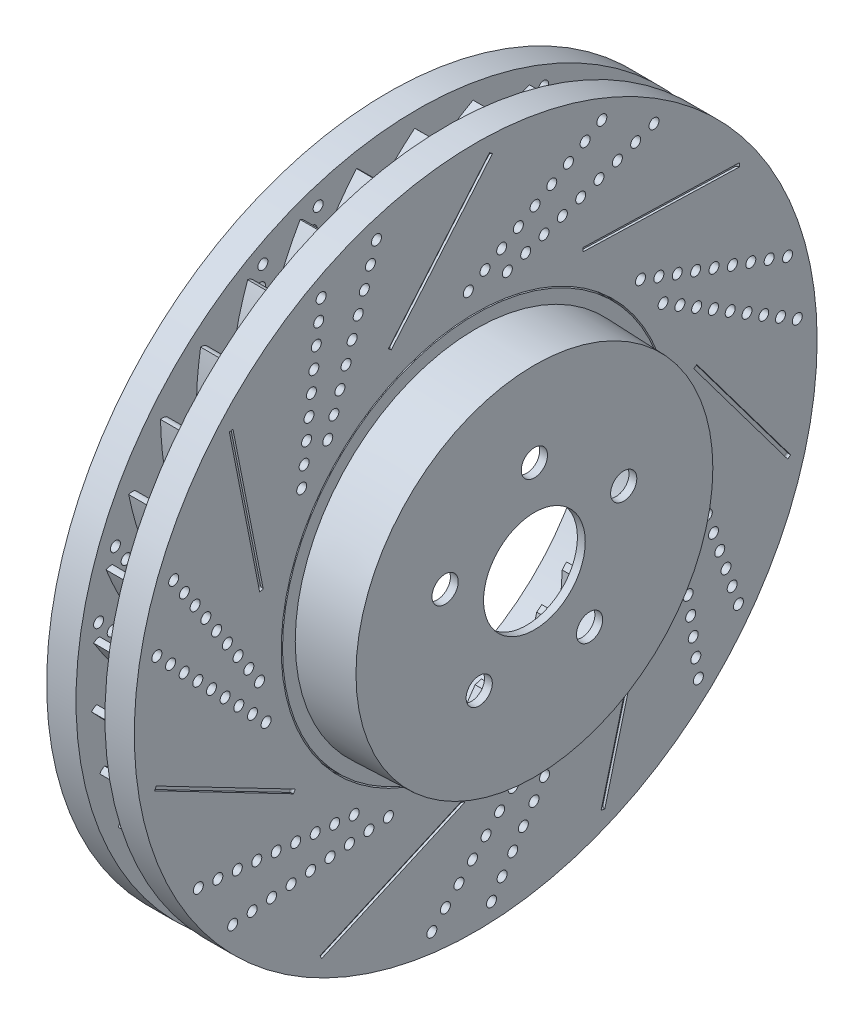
SolidWorks part; units mm, degrees
ref_plane "Front Plane" through (0, 0, 0) normal (0, 0, 1) x (1, 0, 0)
ref_plane "Top Plane" through (0, 0, 0) normal (0, 1, 0) x (1, 0, 0)
ref_plane "Right Plane" through (0, 0, 0) normal (1, 0, 0) x (0, 0, -1)
sketch "Sketch1" plane through (0, 0, 0) normal (1, 0, 0) x (0, 0, -1)
  circle A0 centre (0, 0) radius 87.27
  dimension "D1" = 174.54
extrude "Boss-Extrude1" add sketch "Sketch1" along normal blind 7.5
sketch "Sketch2" plane through (7.5, 0, 0) normal (1, 0, 0) x (0, 0, -1)
  circle A0 centre (0, 0) radius 49.72
  dimension "D1" = 99.44
extrude "Cut-Extrude1" cut sketch "Sketch2" against normal through all
sketch "Sketch3" plane through (7.5, 0, 0) normal (1, 0, 0) x (0, 0, -1)
  line L0 (0, -87.27) -> (0, 87.27) construction
  line L1 (-22.32, -50.7212) -> (-48.3823, -53.3272) construction
  line L2 (-31.0722, -45.884) -> (-58.4611, -43.348) construction
  line L3 (-48.3823, -53.3272) -> (-67.5581, -55.2445) construction
  line L4 (-58.4611, -43.348) -> (-76.684, -41.6607) construction
  circle A0 centre (0, 0) radius 55.415 construction
  circle A1 centre (0, 0) radius 87.27 construction
  circle A2 centre (-22.32, -50.7212) radius 1.28
  circle A3 centre (-31.0722, -45.884) radius 1.28
  circle A4 centre (-27.2952, -51.2187) radius 1.28
  circle A5 centre (-32.2704, -51.7161) radius 1.28
  circle A6 centre (-37.2456, -52.2136) radius 1.28
  circle A7 centre (-42.2208, -52.7111) radius 1.28
  circle A8 centre (-47.196, -53.2085) radius 1.28
  circle A9 centre (-52.1711, -53.706) radius 1.28
  circle A10 centre (-57.1463, -54.2035) radius 1.28
  circle A11 centre (-62.1215, -54.7009) radius 1.28
  circle A12 centre (-36.0509, -45.423) radius 1.28
  circle A13 centre (-41.0296, -44.962) radius 1.28
  circle A14 centre (-46.0083, -44.501) radius 1.28
  circle A15 centre (-50.987, -44.04) radius 1.28
  circle A16 centre (-55.9657, -43.5791) radius 1.28
  circle A17 centre (-60.9444, -43.1181) radius 1.28
  circle A18 centre (-65.9231, -42.6571) radius 1.28
  circle A19 centre (-70.9019, -42.1961) radius 1.28
  dimension "D1" = 110.83
  dimension "D2" = 2.56
  dimension "D3" = 10
  dimension "D4" = 22.32
  dimension "D5" = 84.29
  dimension "D6" = 95.29
  dimension "D7" = 9
  dimension "D8" = 9
extrude "Cut-Extrude2" cut sketch "Sketch3" against normal through all
pattern_circular "CirPattern1" count 7 over 360 about axis through (0, 0, 0) along (1, 0, 0) of "Cut-Extrude2"
sketch "Sketch5" plane through (7.5, 0, 0) normal (1, 0, 0) x (0, 0, -1)
  line L0 (0, 0) -> (0, -97.8104) construction
  line L1 (-3.2223, -56.4491) -> (-2.84, -57.3078)
  line L2 (-3.2223, -56.4491) -> (-39.7642, -72.7186)
  line L3 (-2.84, -57.3078) -> (-39.3818, -73.5773)
  line L4 (-39.7642, -72.7186) -> (-39.3818, -73.5773)
  dimension "D1" = 2.84
  dimension "D2" = 66
  dimension "D3" = 0.94
  dimension "D4" = 40
extrude "Cut-Extrude3" cut sketch "Sketch5" against normal blind 0.6
fillet "Fillet1" radius 0.6 2 edges at (6.9, -73.1479, 39.573) (6.9, -56.8785, 3.0312)
pattern_circular "CirPattern2" count 7 over 360 about axis through (0, 0, 0) along (1, 0, 0) of "Fillet1", "Cut-Extrude3"
ref_plane "Plane1" through (-3.7, 0, 0) normal (-1, 0, 0) x (0, 0, 1)
mirror "Mirror2" about plane through (-3.7, 0, 0) normal (-1, 0, 0)
sketch "Sketch8" plane through (0, 0, 0) normal (-1, 0, 0) x (0, 0, 1)
  line L0 (0, 0) -> (0, -49.72) construction
  line L1 (0, 0) -> (-188.7767, 0) construction
  circle A0 centre (0, 0) radius 49.72 construction
  arc A1 (-36.7738, 33.4629) -> (-37.8669, 32.2207) centre (0, 0) ccw
  arc A2 (-81.2799, 10.8679) -> (-82.5799, 11.8995) centre (-80.4495, 13.2494) cw
  arc A3 (-30.2078, 39.4914) -> (-31.5051, 38.4643) centre (0, 0) ccw
  arc A4 (-78.0331, 25.2064) -> (-79.1281, 26.4534) centre (-76.7909, 27.4013) cw
  arc A5 (-22.6709, 44.2505) -> (-24.1307, 43.4717) centre (0, 0) ccw
  arc A6 (-72.2783, 38.7346) -> (-73.133, 40.1572) centre (-70.6641, 40.6725) cw
  arc A7 (-14.4053, 47.5875) -> (-15.9808, 47.0818) centre (0, 0) ccw
  arc A8 (-64.2005, 51.018) -> (-64.7874, 52.5703) centre (-62.2662, 52.6364) cw
  arc A9 (-5.6767, 49.3949) -> (-7.3172, 49.1786) centre (0, 0) ccw
  arc A10 (-54.0591, 61.6615) -> (-54.3595, 63.2937) centre (-51.8669, 62.9086) cw
  arc A11 (3.2343, 49.6147) -> (1.5816, 49.6948) centre (0, 0) ccw
  arc A12 (-42.1803, 70.3232) -> (-42.1844, 71.9828) centre (-39.8006, 71.1588) cw
  arc A13 (12.0414, 48.2399) -> (10.4295, 48.6138) centre (0, 0) ccw
  arc A14 (-28.9457, 76.7247) -> (-28.6534, 78.3583) centre (-26.4551, 77.1219) cw
  arc A15 (20.4614, 45.3146) -> (18.9422, 45.9703) centre (0, 0) ccw
  arc A16 (-14.7808, 80.6601) -> (-14.2015, 82.2153) centre (-12.2593, 80.6063) cw
  arc A17 (28.2238, 40.9328) -> (26.8461, 41.8493) centre (0, 0) ccw
  arc A18 (-0.1409, 82.0031) -> (0.7068, 83.4298) centre (2.3305, 81.4999) cw
  arc A19 (35.0791, 35.2354) -> (33.8872, 36.3832) centre (0, 0) ccw
  arc A20 (14.5036, 80.7104) -> (15.5924, 81.9629) centre (16.8454, 79.7741) cw
  arc A21 (40.8069, 28.4056) -> (39.8391, 29.7477) centre (0, 0) ccw
  arc A22 (28.6819, 76.8237) -> (29.9769, 77.8616) centre (30.8189, 75.4842) cw
  arc A23 (45.2231, 20.6627) -> (44.5105, 22.1561) centre (0, 0) ccw
  arc A24 (41.9384, 70.4677) -> (43.3979, 71.2577) centre (43.8019, 68.7682) cw
  arc A25 (48.1858, 12.2558) -> (47.7513, 13.8524) centre (0, 0) ccw
  arc A26 (53.8469, 61.8469) -> (55.424, 62.3636) centre (55.377, 59.8419) cw
  arc A27 (49.5998, 3.4549) -> (49.4574, 5.1034) centre (0, 0) ccw
  arc A28 (64.0248, 51.2383) -> (65.6688, 51.4651) centre (65.1723, 48.9923) cw
  arc A29 (49.4196, -5.457) -> (49.5738, -3.8095) centre (0, 0) ccw
  arc A30 (72.1448, 38.9828) -> (73.8029, 38.9124) centre (72.8728, 36.568) cw
  arc A31 (47.651, -14.1935) -> (48.097, -12.6001) centre (0, 0) ccw
  arc A32 (77.9461, 25.4744) -> (79.5649, 25.109) centre (78.2312, 22.9684) cw
  arc A33 (44.3509, -22.4738) -> (45.0742, -20.9856) centre (0, 0) ccw
  arc A34 (81.2421, 11.1472) -> (82.7697, 10.4987) centre (81.0752, 8.6306) cw
  arc A35 (39.6253, -30.0318) -> (40.6027, -28.6967) centre (0, 0) ccw
  arc A36 (81.9269, -3.5383) -> (83.3141, -4.4492) centre (81.3133, -5.9846) cw
  arc A37 (33.6261, -36.6246) -> (34.8262, -35.4854) centre (0, 0) ccw
  arc A38 (79.9785, -18.1101) -> (81.1808, -19.254) centre (78.938, -20.4075) cw
  arc A39 (26.5462, -42.0402) -> (27.9304, -41.1336) centre (0, 0) ccw
  arc A40 (75.4595, -32.0997) -> (76.4383, -33.4399) centre (74.0255, -34.1745) cw
  arc A41 (18.613, -46.1046) -> (20.1368, -45.4597) centre (0, 0) ccw
  arc A42 (68.5152, -45.0577) -> (69.2389, -46.5511) centre (66.7338, -46.843) cw
  arc A43 (10.0816, -48.6872) -> (11.6961, -48.3247) centre (0, 0) ccw
  arc A44 (59.3688, -56.5675) -> (59.8142, -58.1661) centre (57.2972, -58.006) cw
  arc A45 (1.2261, -49.7049) -> (2.8794, -49.6366) centre (0, 0) ccw
  arc A46 (48.3142, -66.2591) -> (48.467, -67.9116) centre (46.019, -67.3047) cw
  arc A47 (-7.6687, -49.125) -> (-6.0298, -49.353) centre (0, 0) ccw
  arc A48 (35.7068, -73.8211) -> (35.562, -75.4744) centre (33.2618, -74.4401) cw
  arc A49 (-16.3171, -46.9663) -> (-14.7452, -47.4832) centre (0, 0) ccw
  arc A50 (21.9517, -79.0105) -> (21.5141, -80.6113) centre (19.4355, -79.1829) cw
  arc A51 (-24.441, -43.298) -> (-22.9867, -44.0873) centre (0, 0) ccw
  arc A52 (7.491, -81.6604) -> (6.7746, -83.1573) centre (4.9845, -81.3807) cw
  arc A53 (-31.7794, -38.2381) -> (-30.4894, -39.2743) centre (0, 0) ccw
  arc A54 (-7.2104, -81.6856) -> (-8.1825, -83.0306) centre (-9.6267, -80.9629) cw
  arc A55 (-38.0963, -31.9491) -> (-37.0121, -33.1991) centre (0, 0) ccw
  arc A56 (-21.68, -79.0854) -> (-22.8767, -80.2352) centre (-23.9285, -77.9429) cw
  arc A57 (-43.1889, -24.6333) -> (-42.3453, -26.0568) centre (0, 0) ccw
  arc A58 (-35.4529, -73.9434) -> (-36.8357, -74.861) centre (-37.4612, -72.4177) cw
  arc A59 (-46.8932, -16.5258) -> (-46.3174, -18.077) centre (0, 0) ccw
  arc A60 (-48.0862, -66.4247) -> (-49.6106, -67.0807) centre (-49.7899, -64.565) cw
  arc A61 (-49.0904, -7.8871) -> (-48.8008, -9.5162) centre (0, 0) ccw
  arc A62 (-59.1741, -56.7711) -> (-60.7911, -57.1444) centre (-60.5183, -54.6371) cw
  arc A63 (-49.7098, 1.0051) -> (-49.7158, -0.6496) centre (0, 0) ccw
  arc A64 (-68.36, -45.2929) -> (-70.0177, -45.3714) centre (-69.3015, -42.9531) cw
  arc A65 (-48.7315, 9.865) -> (-49.0328, 8.238) centre (0, 0) ccw
  arc A66 (-75.3488, -32.3588) -> (-76.9938, -32.1401) centre (-75.8574, -29.8885) cw
  arc A67 (-46.1869, 18.4078) -> (-46.7739, 16.8607) centre (0, 0) ccw
  arc A68 (-79.9158, -18.3848) -> (-81.4954, -17.8758) centre (-79.9751, -15.8634) cw
  arc A69 (-42.1578, 26.359) -> (-43.0116, 24.9416) centre (0, 0) ccw
  arc A70 (-81.9142, -3.8198) -> (-83.3775, -3.037) centre (-81.5224, -1.3283) cw
  spline S0 degree 2 poles (-37.8669, 32.2207) (-62.3141, 28.1292) (-81.2799, 10.8679) knots 0 0 0 1 1 1
  spline S1 degree 2 poles (-36.7738, 33.4629) (-62.7507, 30.0427) (-82.5799, 11.8995) knots 0 0 0 1 1 1
  spline S2 degree 2 poles (-31.5051, 38.4643) (-56.29, 38.8037) (-78.0331, 25.2064) knots 0 0 0 1 1 1
  spline S3 degree 2 poles (-30.2078, 39.4914) (-56.378, 40.7645) (-79.1281, 26.4534) knots 0 0 0 1 1 1
  spline S4 degree 2 poles (-24.1307, 43.4717) (-48.4567, 48.2311) (-72.2783, 38.7346) knots 0 0 0 1 1 1
  spline S5 degree 2 poles (-22.6709, 44.2505) (-48.1932, 50.1761) (-73.133, 40.1572) knots 0 0 0 1 1 1
  spline S6 degree 2 poles (-15.9808, 47.0818) (-39.066, 56.1083) (-64.2005, 51.018) knots 0 0 0 1 1 1
  spline S7 degree 2 poles (-14.4053, 47.5875) (-38.4594, 57.9749) (-64.7874, 52.5703) knots 0 0 0 1 1 1
  spline S8 degree 2 poles (-7.3172, 49.1786) (-28.4197, 62.1821) (-54.0591, 61.6615) knots 0 0 0 1 1 1
  spline S9 degree 2 poles (-5.6767, 49.3949) (-27.4895, 63.9104) (-54.3595, 63.2937) knots 0 0 0 1 1 1
  spline S10 degree 2 poles (1.5816, 49.6948) (-16.8599, 66.2573) (-42.1803, 70.3232) knots 0 0 0 1 1 1
  spline S11 degree 2 poles (3.2343, 49.6147) (-15.6361, 67.7918) (-42.1844, 71.9828) knots 0 0 0 1 1 1
  spline S12 degree 2 poles (10.4295, 48.6138) (-4.7583, 68.203) (-28.9457, 76.7247) knots 0 0 0 1 1 1
  spline S13 degree 2 poles (12.0414, 48.2399) (-3.2802, 69.4943) (-28.6534, 78.3583) knots 0 0 0 1 1 1
  spline S14 degree 2 poles (18.9422, 45.9703) (7.4963, 67.9566) (-14.7808, 80.6601) knots 0 0 0 1 1 1
  spline S15 degree 2 poles (20.4614, 45.3146) (9.1813, 68.9632) (-14.2015, 82.2153) knots 0 0 0 1 1 1
  spline S16 degree 2 poles (26.8461, 41.8493) (19.51, 65.526) (-0.1409, 82.0031) knots 0 0 0 1 1 1
  spline S17 degree 2 poles (28.2238, 40.9328) (21.3476, 66.2156) (0.7068, 83.4298) knots 0 0 0 1 1 1
  spline S18 degree 2 poles (33.8872, 36.3832) (30.8965, 60.9893) (14.5036, 80.7104) knots 0 0 0 1 1 1
  spline S19 degree 2 poles (35.0791, 35.2354) (32.8277, 61.3397) (15.5924, 81.9629) knots 0 0 0 1 1 1
  spline S20 degree 2 poles (39.8391, 29.7477) (41.2901, 54.4924) (28.6819, 76.8237) knots 0 0 0 1 1 1
  spline S21 degree 2 poles (40.8069, 28.4056) (43.2528, 54.4923) (29.9769, 77.8616) knots 0 0 0 1 1 1
  spline S22 degree 2 poles (44.5105, 22.1561) (50.3565, 46.2441) (41.9384, 70.4677) knots 0 0 0 1 1 1
  spline S23 degree 2 poles (45.2231, 20.6627) (52.2877, 45.8935) (43.3979, 71.2577) knots 0 0 0 1 1 1
  spline S24 degree 2 poles (47.7513, 13.8524) (57.8045, 36.5094) (53.8469, 61.8469) knots 0 0 0 1 1 1
  spline S25 degree 2 poles (48.1858, 12.2558) (59.642, 35.8197) (55.424, 62.3636) knots 0 0 0 1 1 1
  spline S26 degree 2 poles (49.4574, 5.1034) (63.3945, 25.6013) (64.0248, 51.2383) knots 0 0 0 1 1 1
  spline S27 degree 2 poles (49.5998, 3.4549) (65.0794, 24.5945) (65.6688, 51.4651) knots 0 0 0 1 1 1
  spline S28 degree 2 poles (49.5738, -3.8095) (66.947, 13.8703) (72.1448, 38.9828) knots 0 0 0 1 1 1
  spline S29 degree 2 poles (49.4196, -5.457) (68.4251, 12.5789) (73.8029, 38.9124) knots 0 0 0 1 1 1
  spline S30 degree 2 poles (48.097, -12.6001) (68.3478, 1.6936) (77.9461, 25.4744) knots 0 0 0 1 1 1
  spline S31 degree 2 poles (47.651, -14.1935) (69.5715, 0.159) (79.5649, 25.109) knots 0 0 0 1 1 1
  spline S32 degree 2 poles (45.0742, -20.9856) (67.5518, -10.5376) (81.2421, 11.1472) knots 0 0 0 1 1 1
  spline S33 degree 2 poles (44.3509, -22.4738) (68.4819, -12.266) (82.7697, 10.4987) knots 0 0 0 1 1 1
  spline S34 degree 2 poles (40.6027, -28.6967) (64.5847, -22.4301) (81.9269, -3.5383) knots 0 0 0 1 1 1
  spline S35 degree 2 poles (39.6253, -30.0318) (65.1911, -24.2968) (83.3141, -4.4492) knots 0 0 0 1 1 1
  spline S36 degree 2 poles (34.8262, -35.4854) (59.5417, -33.6017) (79.9785, -18.1101) knots 0 0 0 1 1 1
  spline S37 degree 2 poles (33.6261, -36.6246) (59.8051, -35.5467) (81.1808, -19.254) knots 0 0 0 1 1 1
  spline S38 degree 2 poles (27.9304, -41.1336) (52.5851, -43.6933) (75.4595, -32.0997) knots 0 0 0 1 1 1
  spline S39 degree 2 poles (26.5462, -42.0402) (52.4969, -45.6541) (76.4383, -33.4399) knots 0 0 0 1 1 1
  spline S40 degree 2 poles (20.1368, -45.4597) (43.9383, -52.3806) (68.5152, -45.0577) knots 0 0 0 1 1 1
  spline S41 degree 2 poles (18.613, -46.1046) (43.5014, -54.2941) (69.2389, -46.5511) knots 0 0 0 1 1 1
  spline S42 degree 2 poles (11.6961, -48.3247) (33.8792, -59.3843) (59.3688, -56.5675) knots 0 0 0 1 1 1
  spline S43 degree 2 poles (10.0816, -48.6872) (33.1078, -61.189) (59.8142, -58.1661) knots 0 0 0 1 1 1
  spline S44 degree 2 poles (2.8794, -49.6366) (22.7313, -64.4793) (48.3142, -66.2591) knots 0 0 0 1 1 1
  spline S45 degree 2 poles (1.2261, -49.7049) (21.65, -66.1173) (48.467, -67.9116) knots 0 0 0 1 1 1
  spline S46 degree 2 poles (-6.0298, -49.353) (10.8528, -67.5019) (35.7068, -73.8211) knots 0 0 0 1 1 1
  spline S47 degree 2 poles (-7.6687, -49.125) (9.4964, -68.9205) (35.562, -75.4744) knots 0 0 0 1 1 1
  spline S48 degree 2 poles (-14.7452, -47.4832) (-1.3746, -68.355) (21.9517, -79.0105) knots 0 0 0 1 1 1
  spline S49 degree 2 poles (-16.3171, -46.9663) (-2.9625, -69.5086) (21.5141, -80.6113) knots 0 0 0 1 1 1
  spline S50 degree 2 poles (-22.9867, -44.0873) (-13.5577, -67.0111) (7.491, -81.6604) knots 0 0 0 1 1 1
  spline S51 degree 2 poles (-24.441, -43.298) (-15.3261, -67.8626) (6.7746, -83.1573) knots 0 0 0 1 1 1
  spline S52 degree 2 poles (-30.4894, -39.2743) (-25.3051, -63.5133) (-7.2104, -81.6856) knots 0 0 0 1 1 1
  spline S53 degree 2 poles (-31.7794, -38.2381) (-27.1971, -64.0354) (-8.1825, -83.0306) knots 0 0 0 1 1 1
  spline S54 degree 2 poles (-37.0121, -33.1991) (-36.2392, -57.9742) (-21.68, -79.0854) knots 0 0 0 1 1 1
  spline S55 degree 2 poles (-38.0963, -31.9491) (-38.194, -58.1501) (-22.8767, -80.2352) knots 0 0 0 1 1 1
  spline S56 degree 2 poles (-42.3453, -26.0568) (-46.0085, -50.5718) (-35.4529, -73.9434) knots 0 0 0 1 1 1
  spline S57 degree 2 poles (-43.1889, -24.6333) (-47.9633, -50.3958) (-36.8357, -74.861) knots 0 0 0 1 1 1
  spline S58 degree 2 poles (-46.3174, -18.077) (-54.2991, -41.544) (-48.0862, -66.4247) knots 0 0 0 1 1 1
  spline S59 degree 2 poles (-46.8932, -16.5258) (-56.1911, -41.0217) (-49.6106, -67.0807) knots 0 0 0 1 1 1
  spline S60 degree 2 poles (-48.8008, -9.5162) (-60.8445, -31.1809) (-59.1741, -56.7711) knots 0 0 0 1 1 1
  spline S61 degree 2 poles (-49.0904, -7.8871) (-62.6128, -30.3292) (-60.7911, -57.1444) knots 0 0 0 1 1 1
  spline S62 degree 2 poles (-49.7158, -0.6496) (-65.4342, -19.8156) (-68.36, -45.2929) knots 0 0 0 1 1 1
  spline S63 degree 2 poles (-49.7098, 1.0051) (-67.022, -18.6619) (-70.0177, -45.3714) knots 0 0 0 1 1 1
  spline S64 degree 2 poles (-49.0328, 8.238) (-67.9209, -7.8134) (-75.3488, -32.3588) knots 0 0 0 1 1 1
  spline S65 degree 2 poles (-48.7315, 9.865) (-69.2772, -6.3947) (-76.9938, -32.1401) knots 0 0 0 1 1 1
  spline S66 degree 2 poles (-46.7739, 16.8607) (-68.2245, 4.4399) (-79.9158, -18.3848) knots 0 0 0 1 1 1
  spline S67 degree 2 poles (-46.1869, 18.4078) (-69.3057, 6.078) (-81.4954, -17.8758) knots 0 0 0 1 1 1
  spline S68 degree 2 poles (-43.0116, 24.9416) (-66.3353, 16.5505) (-81.9142, -3.8198) knots 0 0 0 1 1 1
  spline S69 degree 2 poles (-42.1578, 26.359) (-67.1066, 18.3553) (-83.3775, -3.037) knots 0 0 0 1 1 1
  point P254 (0, 0)
  dimension "D1" = 35
extrude "Boss-Extrude2" add sketch "Sketch8" along normal blind 7.4
sketch "Sketch9" plane through (-14.9, 0, 0) normal (-1, 0, 0) x (0, 0, 1)
  circle A0 centre (0, 0) radius 53.345
  dimension "D1" = 106.69
extrude "Cut-Extrude5" cut sketch "Sketch9" against normal up to surface (7.5 mm away)
sketch "Sketch10" plane through (0, 0, 0) normal (0, 1, 0) x (1, 0, 0)
  line L0 (0, 0) -> (161.2145, 0) construction
  line L1 (21.6301, -44.395) -> (79.6055, -44.395) construction
  line L2 (0, -44.395) -> (20.5, -43.6791)
  line L3 (22.5, -45.6105) -> (22.5, 0)
  line L4 (0, 14.7808) -> (0, -18.9422) construction
  line L5 (20.5, -43.6791) -> (20.5, 0)
  line L6 (0, -44.395) -> (0, -51.395)
  line L7 (0, 87.27) -> (0, -87.27) construction
  line L8 (0, -51.395) -> (4, -51.395)
  line L9 (7.5, -49.395) -> (7.5, -46.1343)
  line L10 (7.5, -87.27) -> (7.5, 87.27) construction
  line L11 (7.5, -46.1343) -> (22.5, -45.6105)
  line L13 (20.5, 0) -> (22.5, 0)
  line L14 (4, -51.395) -> (4, -49.395)
  line L15 (4, -49.395) -> (7.5, -49.395)
  dimension "D1" = 2
  dimension "D2" = 2
  dimension "D3" = 15
  dimension "D4" = 44.395
  dimension "D5" = 13
  dimension "D6" = 4
  dimension "D7" = 7
  dimension "D8" = 2
revolve "Revolve1" add sketch "Sketch10" angle 360 about L0
sketch "Sketch11" plane through (22.5, 0, 0) normal (1, 0, 0) x (0, 0, -1)
  circle A0 centre (0, 0) radius 13
  circle A1 centre (0, 0) radius 24 construction
  circle A2 centre (0, 24) radius 3.35
  circle A3 centre (22.8254, 7.4164) radius 3.35
  circle A4 centre (14.1068, -19.4164) radius 3.35
  circle A5 centre (-14.1068, -19.4164) radius 3.35
  circle A6 centre (-22.8254, 7.4164) radius 3.35
  point P17 (0, 0)
  dimension "D1" = 26
  dimension "D2" = 48
  dimension "D3" = 6.7
  dimension "D4" = 5
extrude "Cut-Extrude6" cut sketch "Sketch11" against normal blind 7.5
